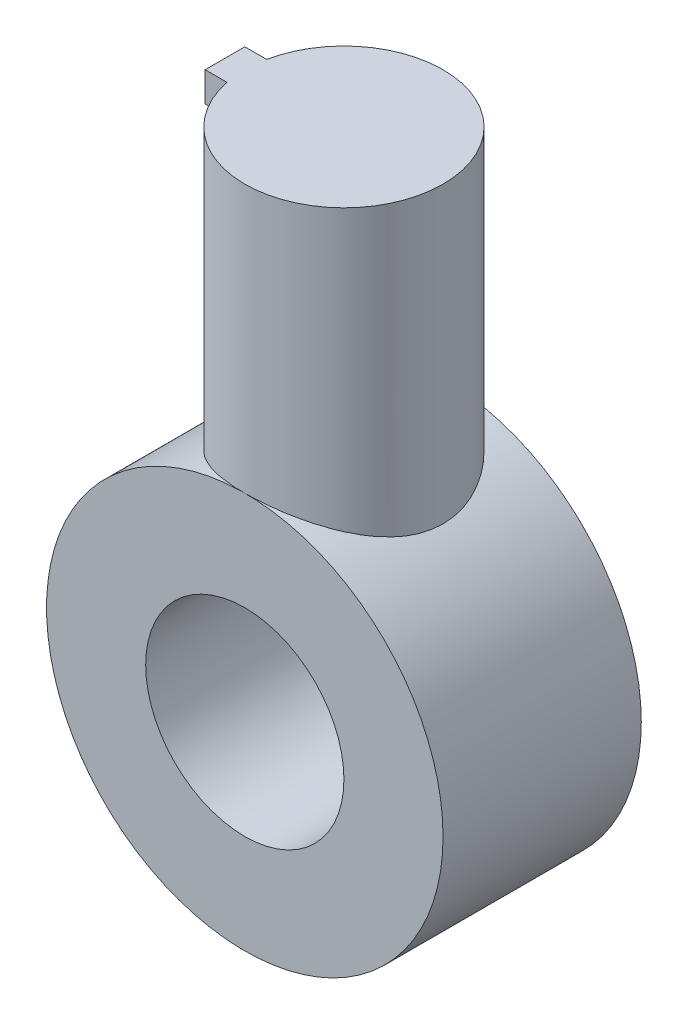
SolidWorks part; units mm, degrees
ref_plane "Front Plane" through (0, 0, 0) normal (0, 0, 1) x (1, 0, 0)
ref_plane "Top Plane" through (0, 0, 0) normal (0, 1, 0) x (1, 0, 0)
ref_plane "Right Plane" through (0, 0, 0) normal (1, 0, 0) x (0, 0, -1)
sketch "Sketch1" plane through (0, 0, 0) normal (0, 0, 1) x (1, 0, 0)
  circle A0 centre (0, 0) radius 20
  circle A1 centre (0, 0) radius 10
  dimension "D1" = 40
  dimension "D2" = 20
extrude "Boss-Extrude1" add sketch "Sketch1" along normal blind 20
ref_plane "Plane1" through (0, 17, 0) normal (0, 1, 0) x (1, 0, 0)
sketch "Sketch2" plane through (0, 17, 0) normal (0, 1, 0) x (1, 0, 0)
  line L0 (0, 0) -> (0, -20) construction
  line L1 (-8.609, -20) -> (6.4271, -20) construction
  line L2 (-20, -20) -> (20, -20) construction
  circle A0 centre (0, -10) radius 10
extrude "Boss-Extrude2" add sketch "Sketch2" along normal blind 30 separate body
sketch "Sketch3" plane through (0, 47, 0) normal (0, 1, 0) x (1, 0, 0)
  line L0 (-12, -3.0525) -> (-12, -16.9475) construction
  line L1 (0, 0) -> (0, -20) construction
  line L2 (10, -8) -> (9.798, -8)
  line L3 (10, -12) -> (9.798, -12)
  line L4 (-10, -10) -> (-10, -8) construction
  line L5 (-10, -8) -> (-10, -12) construction
  line L6 (-12, -8) -> (-12, -12)
  line L7 (-9.798, -8) -> (-12, -8)
  line L8 (-10, -3.0525) -> (-10, -16.9475) construction
  line L9 (-10, -10) -> (-12, -10) construction
  line L11 (-9.798, -12) -> (-12, -12)
  circle A0 centre (0, -10) radius 10 construction
  arc A2 (-9.798, -8) -> (-9.798, -12) centre (0, -10) ccw
  dimension "D3" = 2
extrude "Boss-Extrude3" add sketch "Sketch3" against normal blind 3 contours L11 L7 L6 M4
